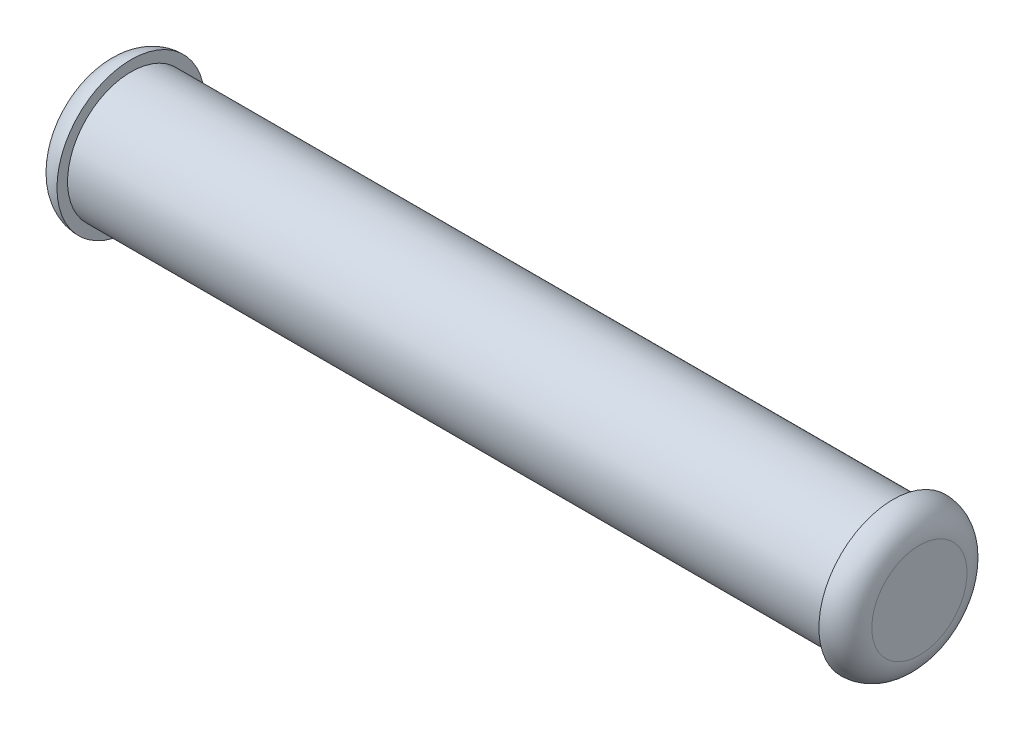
SolidWorks part; units mm, degrees
ref_plane "Спереди" through (0, 0, 0) normal (0, 0, 1) x (1, 0, 0)
ref_plane "Сверху" through (0, 0, 0) normal (0, 1, 0) x (1, 0, 0)
ref_plane "Справа" through (0, 0, 0) normal (1, 0, 0) x (0, 0, -1)
sketch "Эскиз1" plane through (0, 0, 0) normal (1, 0, 0) x (0, 0, -1)
  circle A0 centre (0, 0) radius 2.4
  dimension "D1" = 4.8
extrude "Бобышка-Вытянуть1" add sketch "Эскиз1" along normal mid plane 28.8
sketch "Эскиз2" plane through (14.4, 0, 0) normal (1, 0, 0) x (0, 0, -1)
  circle A0 centre (0, 0) radius 2.8
extrude "Бобышка-Вытянуть2" add sketch "Эскиз2" along normal blind 1
mirror "Зеркальное отражение1" about plane through (0, 0, 0) normal (1, 0, 0) of "Бобышка-Вытянуть2"
fillet "Скругление1" radius 1 2 edges at (-15.4, 0, -2.8) (15.4, 0, -2.8)
